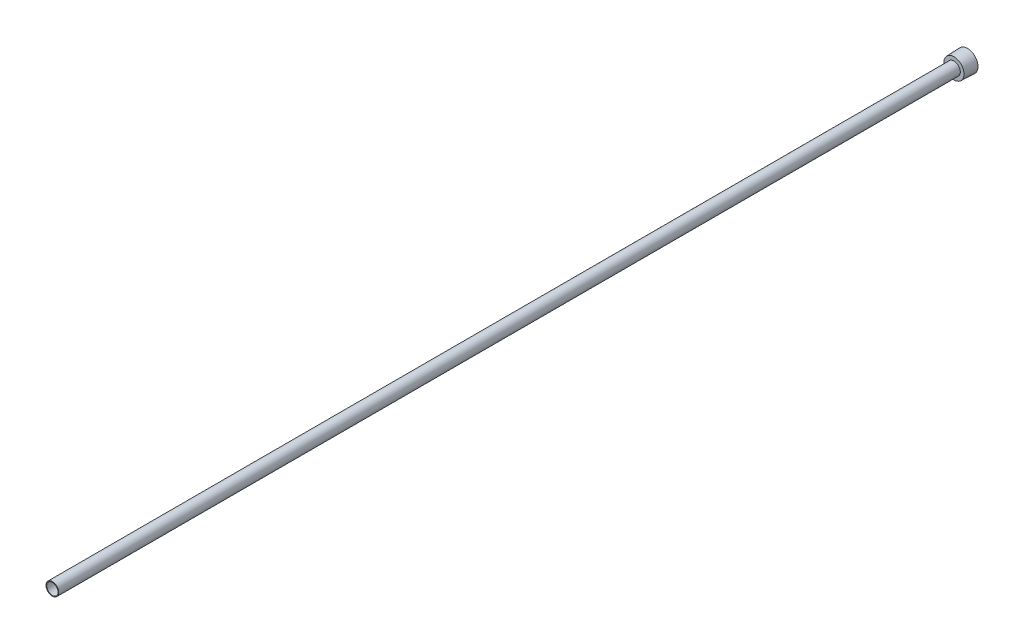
SolidWorks part; units mm, degrees
ref_plane "Front Plane" through (0, 0, 0) normal (0, 0, 1) x (1, 0, 0)
ref_plane "Top Plane" through (0, 0, 0) normal (0, 1, 0) x (1, 0, 0)
ref_plane "Right Plane" through (0, 0, 0) normal (1, 0, 0) x (0, 0, -1)
sketch "Sketch1" plane through (0, 0, 0) normal (1, 0, 0) x (0, 0, -1)
  line L0 (-223.2122, 0) -> (49776.7878, 0) construction
  line L6 (0, 10.541) -> (-13.4874, 10.049)
  line L7 (0, 0) -> (0, 10.541)
  line L8 (-13.4874, 10.049) -> (-13.4874, 6.35)
  line L9 (-13.4874, 6.35) -> (-914.4, 6.35)
  line L10 (-914.4, 6.35) -> (-914.4, 0)
  line L11 (0, 0) -> (-914.4, 0)
  dimension "D1" = 2.089
  dimension "D2" = 13.4874
  dimension "D3" = 21.082
  dimension "D4" = 12.7
  dimension "D5" = 914.4
revolve "Revolve1" add sketch "Sketch1" angle 360 about L0
sketch "Sketch2" plane through (0, 0, 914.4) normal (0, 0, 1) x (1, 0, 0)
  circle A0 centre (0, 0) radius 5.6388
  dimension "D1" = 11.2776
extrude "Cut-Extrude1" cut sketch "Sketch2" against normal through all
sketch "Sketch3" plane through (0, 0, 0) normal (0, 0, -1) x (-1, 0, 0)
  line L0 (0, 11.5951) -> (0, -11.5951) construction
  line L1 (0, -7.3323) -> (6.35, -3.6662)
  line L2 (6.35, -3.6662) -> (6.35, 3.6662)
  line L3 (6.35, 3.6662) -> (0, 7.3323)
  line L4 (0, 7.3323) -> (-6.35, 3.6662)
  line L5 (-6.35, 3.6662) -> (-6.35, -3.6662)
  line L6 (-6.35, -3.6662) -> (0, -7.3323)
  circle A0 centre (0, 0) radius 6.35 construction
  dimension "D1" = 12.7
extrude "Cut-Extrude2" cut sketch "Sketch3" against normal blind 9.525
